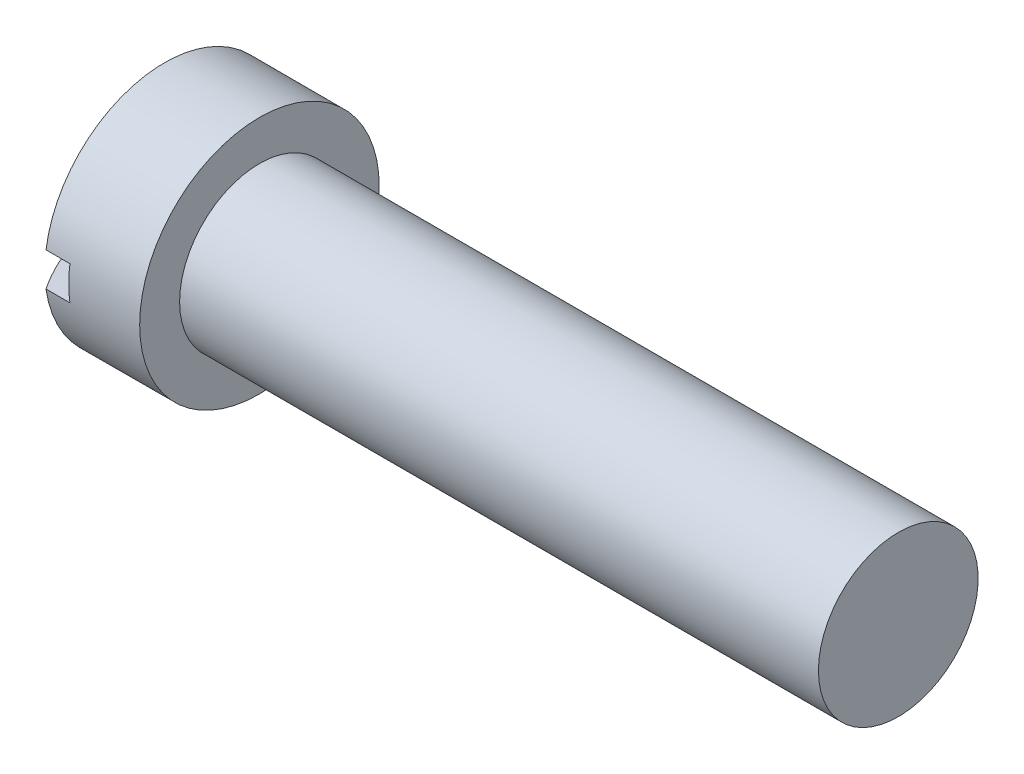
SolidWorks part; units mm, degrees
ref_plane "Plane1" through (0, 0, 0) normal (0, 0, 1) x (1, 0, 0)
ref_plane "Plane2" through (0, 0, 0) normal (0, 1, 0) x (1, 0, 0)
ref_plane "Plane3" through (0, 0, 0) normal (1, 0, 0) x (0, 0, -1)
sketch "BodySke" plane through (0, 0, 0) normal (0, 0, 1) x (1, 0, 0)
  line L0 (10.4648, 6.35) -> (10.4648, 9.525)
  line L1 (10.4648, 9.525) -> (2.921, 9.525)
  line L2 (-25.4, 0) -> (127, 0) construction
  line L3 (61.2648, 0) -> (0, 0)
  line L4 (10.4648, 6.35) -> (61.2648, 6.35)
  line L5 (61.2648, 6.35) -> (61.2648, 0)
  line L6 (10.4648, -9.525) -> (2.921, -9.525) construction
  line L7 (10.4648, -6.35) -> (61.2648, -6.35) construction
  line L8 (11.7348, 1.2192) -> (11.7348, -0.4698) construction
  line L9 (10.4648, 1.2192) -> (10.4648, -0.4698) construction
  arc A0 (0, 0) -> (2.921, 9.525) centre (16.9904, 0) cw
  dimension "Head_ht" = 10.4648
  dimension "Diameter" = 12.7
  dimension "Length" = 50.8
  dimension "Head_dia" = 19.05
  dimension "Head_side_ht" = 7.5438
  dimension "Advance" = 1.27
  dimension "Thread_nom" = 50.8
revolve "Base-Revolve" add sketch "BodySke" angle 360 about L2
sketch "Sketch2" plane through (0, 0, 0) normal (1, 0, 0) x (0, 0, -1)
  line L0 (-9.525, -1.3462) -> (-9.525, 1.3462)
  line L1 (-9.525, 1.3462) -> (9.525, 1.3462)
  line L2 (9.525, 1.3462) -> (9.525, -1.3462)
  line L3 (9.525, -1.3462) -> (-9.525, -1.3462)
  dimension "D1" = 19.05
  dimension "D2" = 9.525
  dimension "D3" = 1.3462
  dimension "Slot_width" = 2.6924
extrude "Slot" cut sketch "Sketch2" along normal blind 4.826
sketch "Sketch3" plane through (0, 0, 0) normal (1, 0, 0) x (0, 0, -1)
  line L0 (1.1557, -7.1374) -> (-1.1557, -7.1374)
  line L1 (1.1557, -7.1374) -> (1.1557, 7.1374)
  line L2 (-1.1557, 7.1374) -> (1.1557, 7.1374)
  line L3 (-1.1557, 7.1374) -> (-1.1557, -7.1374)
  dimension "D1" = 1.1557
  dimension "Cross_width" = 2.3114
  dimension "D2" = 7.1374
  dimension "Cross_dia" = 14.2748
ref_plane "Plane4" through (8.6106, 0, 0) normal (1, 0, 0) x (0, 0, -1)
sketch "Sketch4" plane through (8.6106, 0, 0) normal (1, 0, 0) x (0, 0, -1)
  line L0 (0.5778, -0.5778) -> (-0.5778, -0.5779)
  line L1 (0.5778, -0.5778) -> (0.5779, 0.5778)
  line L2 (-0.5778, 0.5778) -> (0.5779, 0.5778)
  line L3 (-0.5778, 0.5778) -> (-0.5778, -0.5779)
  dimension "D1" = 1.1557
  dimension "D2" = 0.5778
  dimension "D3" = 1.1557
  dimension "D4" = 0.5778
loft "Cross" [suppressed] cut profiles "Sketch3", "Sketch4"
pattern_circular "CirPattern1" [suppressed] count 2 every 90 about axis through (-25.4, 0, 0) along (1, 0, 0)
sketch "Sketch5" plane through (0, 0, 0) normal (0, 1, 0) x (1, 0, 0)
  line L4 (-25.4, 0) -> (127, 0) construction
  line L5 (10.4648, -6.312) -> (10.4648, 6.3337) construction
  circle A0 centre (7.2709, 0) radius 0.889
  dimension "Drilled_hole_dia" = 1.778
  dimension "D1" = 10.4648
  dimension "Drilled_hole_loc" = 3.1939
extrude "Hole" [suppressed] cut sketch "Sketch5" against normal through all and the other way through all
sketch "ThdSchSke" plane through (0, 0, 0) normal (0, 0, 1) x (1, 0, 0)
  line L0 (11.7348, -5.5943) -> (11.2057, -6.35)
  line L1 (11.7348, -5.5943) -> (12.2639, -6.35)
  line L2 (12.2639, -6.35) -> (12.2639, -7.9375)
  line L3 (-3.175, 0) -> (5.1513, 0) construction
  line L5 (12.2639, -7.9375) -> (11.2057, -7.9375)
  line L6 (11.2057, -7.9375) -> (11.2057, -6.35)
  dimension "Thread_minor" = 11.1887
  dimension "Diameter" = 12.7
  dimension "Start" = 11.7348
  dimension "SideAngle" = 55
  dimension "VeeAngle" = 70
  dimension "Overcut" = 15.875
revolve "ThreadSchematic" [suppressed] cut sketch "ThdSchSke" angle 360 about L3
pattern_linear "ThdSchPat" [suppressed]
equation "\"D1@Sketch3\" = \"Cross_width@Sketch3\" / 2"
equation "\"D2@Sketch3\" = \"Cross_dia@Sketch3\" / 2"
equation "\"D1@Sketch4\" = \"Cross_width@Sketch3\"*.5"
equation "\"D2@Sketch4\" = \"D1@Sketch4\" / 2"
equation "\"D3@Sketch4\" = \"D1@Sketch4\""
equation "\"D4@Sketch4\" = \"D2@Sketch4\""
equation "\"D1@Sketch2\" = \"Head_dia@BodySke\""
equation "\"D2@Sketch2\" = \"D1@Sketch2\" / 2"
equation "\"D3@Sketch2\" = \"Slot_width@Sketch2\" / 2"
equation "\"D1@Sketch5\" = \"Head_ht@BodySke\""
equation "\"Thread_length@ThreadCosmetic\" = ((sgn( (\"Length@BodySke\" - \"Advance@BodySke\" ) - \"Thread_nom@BodySke\" )-1)*( (\"Length@BodySke\" - \"Advance@BodySke\" ) - \"Thread_nom@BodySke\" ))/-2+ \"Thread_nom@BodySke\""
equation "\"Thread_minor@ThdSchSke\" = \"Thread_minor@ThreadCosmetic\""
equation "\"Diameter@ThdSchSke\" = \"Diameter@BodySke\""
equation "\"Overcut@ThdSchSke\" = \"Diameter@BodySke\" * 1.25"
equation "\"Start@ThdSchSke\" = \"Head_ht@BodySke\" + \"Length@BodySke\" - \"Thread_length@ThreadCosmetic\"  '---Non-countersunk---"
equation "\"Num_threads@ThdSchPat\" = int( \"Thread_length@ThreadCosmetic\" / \"Advance@BodySke\" + 0.999 )  + 1"
equation "\"Advance@ThdSchPat\" = \"Thread_length@ThreadCosmetic\" /  (\"Num_threads@ThdSchPat\" - 1) 'relax it"
